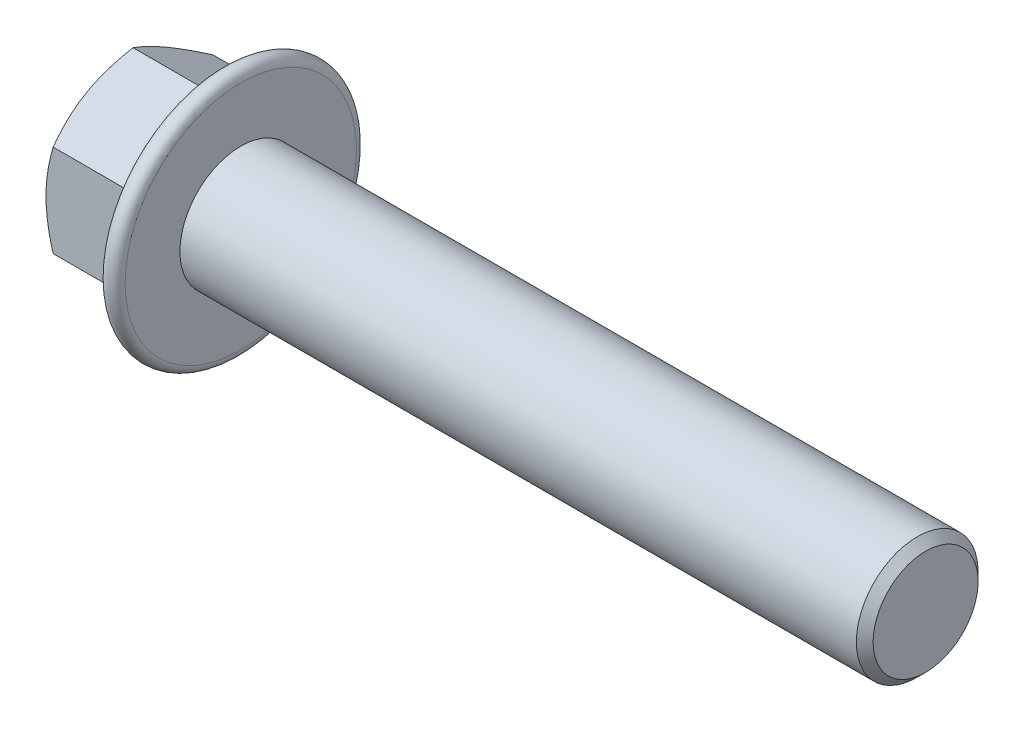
SolidWorks part; units mm, degrees
ref_plane "Front Plane" through (0, 0, 0) normal (0, 0, 1) x (1, 0, 0)
ref_plane "Top Plane" through (0, 0, 0) normal (0, 1, 0) x (1, 0, 0)
ref_plane "Right Plane" through (0, 0, 0) normal (1, 0, 0) x (0, 0, -1)
sketch "BaseHeadSke" plane through (0, 0, 0) normal (1, 0, 0) x (0, 0, -1)
  line L1 (0, 12.1244) -> (-10.5, 6.0622)
  line L2 (-10.5, 6.0622) -> (-10.5, -6.0622)
  line L3 (-10.5, -6.0622) -> (0, -12.1244)
  line L4 (0, -12.1244) -> (10.5, -6.0622)
  line L5 (10.5, -6.0622) -> (10.5, 6.0622)
  line L6 (10.5, 6.0622) -> (0, 12.1244)
  circle A0 centre (0, 0) radius 10.5 construction
  dimension "Width_flats" = 21
extrude "BaseHead" add sketch "BaseHeadSke" along normal blind 15.1
sketch "HeadChamferSke" plane through (0, 0, 0) normal (0, 0, 1) x (1, 0, 0)
  line L0 (0, 0) -> (28.0814, 0) construction
  line L1 (0, 6.0622) -> (0, -6.0622) construction
  line L2 (0, 12.1244) -> (0, 10.5)
  line L3 (0, 10.5) -> (0.9378, 12.1244)
  line L4 (0.9378, 12.1244) -> (0, 12.1244)
  line L7 (15.1, 12.1244) -> (0, 12.1244) construction
  dimension "Angle_Chamfer_Head" = 30
revolve "HeadChamfer" cut sketch "HeadChamferSke" angle 360 about L0
sketch "BodySke" plane through (0, 0, 0) normal (0, 0, 1) x (1, 0, 0)
  line L0 (0, 0) -> (117.0647, 0) construction
  line L1 (0, 0) -> (0, 8)
  line L2 (0, 9.0933) -> (0, 0) construction
  line L3 (0, 8) -> (103.9985, 8)
  line L4 (103.9985, 8) -> (105.1, 6.8985)
  line L5 (105.1, 6.8985) -> (105.1, 0)
  line L6 (105.1, 0) -> (0, 0)
  line L7 (15.1, 6.0622) -> (15.1, -6.0622) construction
  line L8 (17.1, 0) -> (17.1, 14.6766) construction
  line L9 (67.1, 0) -> (67.1, 14.6766) construction
  dimension "Length" = 90
  dimension "Diameter" = 16
  dimension "Thread_minor" = 13.797
  dimension "Body_Chamfer_Angle" = 45
  dimension "Thread_length" = 38
  dimension "Advance" = 2
revolve "BaseBody" add sketch "BodySke" angle 360 about L0
sketch "FlangeSke" plane through (0, 0, 0) normal (0, 0, 1) x (1, 0, 0)
  line L0 (0, 0) -> (112.8691, 0) construction
  line L1 (15.1, 0) -> (15.1, 15.2)
  line L2 (15.1, 0) -> (7.0906, 0)
  line L3 (7.0906, 0) -> (12.7724, 15.6104)
  line L4 (15.1, 12.1244) -> (15.1, 6.0622) construction
  line L5 (12.7, 15.4116) -> (12.7, 24.901) construction
  arc A0 (15.1, 15.2) -> (12.7724, 15.6104) centre (13.9, 15.2) ccw
  dimension "Flange_diameter" = 32.8
  dimension "Flange_Angle" = 20
  dimension "Flange_thickness" = 2.4
revolve "Flange" add sketch "FlangeSke" angle 360 about L0
fillet "FlangeHexFillet" radius 1 6 edges
fillet "HeadFillet" [suppressed] radius 0.8
sketch "ThdSchSke" plane through (0, 0, 0) normal (0, 0, 1) x (1, 0, 0)
  line L0 (0, 0) -> (114.7993, 0) construction
  line L1 (101.9985, 9.2719) -> (101.9985, 8)
  line L2 (101.9985, 9.2719) -> (103.2704, 9.2719)
  line L3 (103.2704, 9.2719) -> (103.2704, 8)
  line L4 (103.2704, 8) -> (102.6345, 6.8985)
  line L5 (102.6345, 6.8985) -> (101.9985, 8)
  dimension "D1" = 2
revolve "ThreadSchematic" [suppressed] cut sketch "ThdSchSke" angle 360 about L0
pattern_linear "ThdSchPat" [suppressed]
equation "\"Thread_length@ThreadCosmetic\" = \"Thread_length@BodySke\""
equation "\"Thread_minor@ThreadCosmetic\" = \"Thread_minor@BodySke\""
equation "\"D1@ThdSchSke\" = \"Advance@BodySke\""
equation "\"Advance@ThdSchPat\" = \"Advance@BodySke\""
equation "\"Tooth_Num@ThdSchPat\" =  int( \"Thread_length@BodySke\" / \"Advance@BodySke\" ) - 1 "
